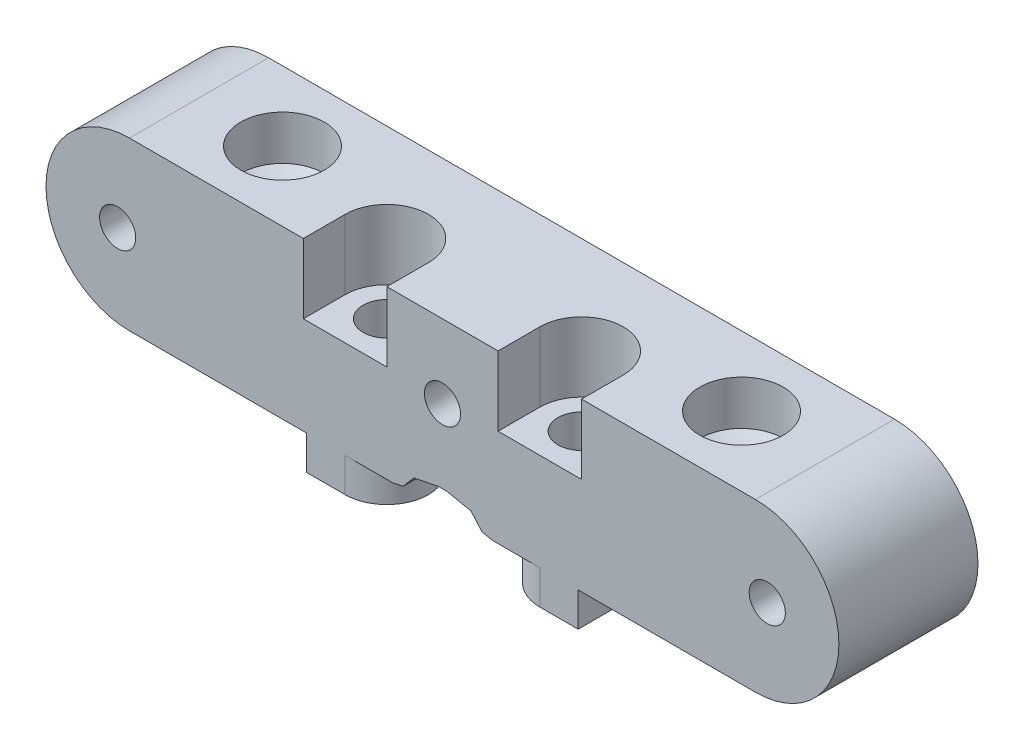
SolidWorks part; units mm, degrees
ref_plane "Płaszczyzna przednia" through (0, 0, 0) normal (0, 0, 1) x (1, 0, 0)
ref_plane "Płaszczyzna górna" through (0, 0, 0) normal (0, 1, 0) x (1, 0, 0)
ref_plane "Płaszczyzna prawa" through (0, 0, 0) normal (1, 0, 0) x (0, 0, -1)
sketch3d "Szkic 3D1"
  line L18 (6.8442, 55.1653, -29.05) -> (6.8442, 55.1653, -10)
  line L19 (6.8442, 55.1653, -10) -> (-3.5, 55.1653, -10)
  line L20 (-3.5, 55.1653, -10) -> (-3.5, 55.1653, 0)
  line L21 (-3.5, 55.1653, 0) -> (8.8442, 55.1653, 0)
  line L22 (8.8442, 55.1653, 0) -> (8.8442, 55.1653, -29.05)
  line L23 (8.8442, 55.1653, -29.05) -> (6.8442, 55.1653, -29.05)
  line L24 (29.1559, 55.1653, -29.05) -> (29.1559, 55.1653, 0)
  line L25 (29.1559, 55.1653, 0) -> (41.5001, 55.1653, 0)
  line L26 (41.5001, 55.1653, 0) -> (41.5001, 55.1653, -10)
  line L27 (41.5001, 55.1653, -10) -> (31.1559, 55.1653, -10)
  line L28 (31.1559, 55.1653, -10) -> (31.1559, 55.1653, -29.05)
  line L29 (31.1559, 55.1653, -29.05) -> (29.1559, 55.1653, -29.05)
  line L30 (29.0359, 79.6512, -6.988) -> (22, 81.5377, -6.988)
  line L31 (22, 81.5377, -6.988) -> (16, 81.5377, -6.988)
  line L32 (16, 81.5377, -6.988) -> (8.9641, 79.6512, -6.988)
  line L33 (8.9641, 71.9242, -6.988) -> (16, 70.0377, -6.988)
  line L34 (16, 70.0377, -6.988) -> (22, 70.0377, -6.988)
  line L35 (22, 70.0377, -6.988) -> (29.0359, 71.9242, -6.988)
  arc A9 (29.0359, 79.6512, -6.988) -> (29.0359, 71.9242, -6.988) centre (28, 75.7877, -6.988) ccw
  arc A10 (8.9641, 71.9242, -6.988) -> (8.9641, 79.6512, -6.988) centre (10, 75.7877, -6.988) ccw
  circle A11 centre (19, 70.4919, 0) radius 1.6
  circle A12 centre (34, 67.4414, 0) radius 2.35
  circle A13 centre (4, 67.4414, 0) radius 2.35
  circle A14 centre (2.5, 55.1653, -5) radius 2.3
  circle A15 centre (35.5001, 55.1653, -5) radius 2.3
  circle A16 centre (10, 75.7877, -6.988) radius 1.6
  circle A17 centre (28, 75.7877, -6.988) radius 1.6
  point P2 (28, 75.7877, -10.988)
  point P4 (10, 75.7877, -10.988)
  point P8 (19, 70.4919, -1.6)
  point P11 (34, 67.4414, -2.35)
  point P16 (4, 67.4414, -2.35)
  point P20 (2.5, 57.4653, -5)
  point P23 (35.5001, 57.4653, -5)
  point P30 (10, 75.7877, -8.588)
  point P36 (28, 75.7877, -8.588)
  dimension "D1" = 4.6
ref_plane "Płaszczyzna1" through (0, 55.1653, 0) normal (0, 1, 0) x (1, 0, 0)
sketch "Szkic2" plane through (0, 55.1653, 0) normal (0, 1, 0) x (1, 0, 0)
  line L1 (-3.5, 0) -> (41.5001, 0)
  line L2 (-3.5, 0) -> (-3.5, 10)
  line L3 (-3.5, 10) -> (41.5001, 10)
  line L4 (41.5001, 0) -> (41.5001, 10)
  circle A0 centre (35.5001, 5) radius 1.7
  circle A1 centre (2.5, 5) radius 1.7
  dimension "D1" = 3.4
extrude "Dodanie-wyciągnięcie1" add sketch "Szkic2" along normal blind 12
sketch "Szkic3" plane through (0, 67.1653, 0) normal (0, 1, 0) x (1, 0, 0)
  line L0 (41.5001, 0) -> (41.5001, 10) construction
  line L1 (-3.5, 0) -> (41.5001, 0)
  line L2 (-3.5, 0) -> (-3.5, 6.5)
  line L3 (-3.5, 6.5) -> (41.5001, 6.5)
  line L4 (41.5001, 0) -> (41.5001, 6.5)
  dimension "D1" = 6.5
extrude "Dodanie-wyciągnięcie2" add sketch "Szkic3" along normal blind 14.5
sketch "Szkic4" plane through (0, 0, -6.5) normal (0, 0, -1) x (-1, 0, 0)
  circle A0 centre (-28, 75.7877) radius 1.7
  circle A1 centre (-10, 75.7877) radius 1.7
  dimension "D1" = 3.4
extrude "Wytnij-wyciągnięcie1" cut sketch "Szkic4" against normal through all
sketch "Szkic5" plane through (0, 67.1653, 0) normal (0, -1, 0) x (1, 0, 0)
  line L1 (34.7001, -6.5) -> (36.3001, -6.5)
  line L2 (34.7001, -6.5) -> (36.3001, -6.5)
  line L3 (1.7, -6.5) -> (3.3, -6.5)
  line L4 (1.7, -6.5) -> (3.3, -6.5)
  arc A1 (36.3001, -6.5) -> (34.7001, -6.5) centre (35.5001, -5) ccw
  arc A2 (36.3001, -6.5) -> (34.7001, -6.5) centre (35.5001, -5) ccw
  arc A3 (3.3, -6.5) -> (1.7, -6.5) centre (2.5, -5) ccw
  arc A4 (3.3, -6.5) -> (1.7, -6.5) centre (2.5, -5) ccw
  dimension "D1" = 0
  dimension "D2" = 0
extrude "Wytnij-wyciągnięcie2" cut sketch "Szkic5" against normal through all
sketch "Szkic7" plane through (0, 0, -10) normal (0, 0, -1) x (-1, 0, 0)
  line L0 (-18.7005, 56.58) -> (-19.2996, 56.58)
  line L1 (-19.2996, 56.58) -> (-21.0498, 56.2301)
  line L2 (-21.0498, 56.2301) -> (-21.8427, 55.3159)
  line L3 (-21.8427, 55.3159) -> (-28.3862, 54.0065)
  line L4 (-28.3862, 54.0065) -> (-29.2559, 52.9456)
  line L5 (-29.2559, 52.9456) -> (-29.2559, 44.935)
  line L6 (-29.2559, 44.935) -> (-28.3862, 43.8741)
  line L7 (-28.3862, 43.8741) -> (-21.8427, 42.5647)
  line L8 (-21.8427, 42.5647) -> (-21.0498, 41.6505)
  line L9 (-21.0498, 41.6505) -> (-19.2996, 41.3006)
  line L10 (-19.2996, 41.3006) -> (-18.7005, 41.3006)
  line L11 (-18.7005, 41.3006) -> (-16.9503, 41.6505)
  line L12 (-16.9503, 41.6505) -> (-16.1574, 42.5647)
  line L13 (-16.1574, 42.5647) -> (-9.6138, 43.8741)
  line L14 (-9.6138, 43.8741) -> (-8.7442, 44.935)
  line L15 (-8.7442, 44.935) -> (-8.7442, 52.9456)
  line L16 (-8.7442, 52.9456) -> (-9.6138, 54.0065)
  line L17 (-9.6138, 54.0065) -> (-16.1574, 55.3159)
  line L18 (-16.1574, 55.3159) -> (-16.9503, 56.2301)
  line L19 (-16.9503, 56.2301) -> (-18.7005, 56.58)
  line L20 (-18.75, 56.08) -> (-19.2501, 56.08)
  line L21 (-19.2501, 56.08) -> (-20.7841, 55.7733)
  line L22 (-20.7841, 55.7733) -> (-21.5769, 54.8591)
  line L23 (-21.5769, 54.8591) -> (-28.1129, 53.5513)
  line L24 (-28.1129, 53.5513) -> (-28.7559, 52.7669)
  line L25 (-28.7559, 52.7669) -> (-28.7559, 45.1137)
  line L26 (-28.7559, 45.1137) -> (-28.1129, 44.3293)
  line L27 (-28.1129, 44.3293) -> (-21.5769, 43.0215)
  line L28 (-21.5769, 43.0215) -> (-20.7841, 42.1073)
  line L29 (-20.7841, 42.1073) -> (-19.2501, 41.8006)
  line L30 (-19.2501, 41.8006) -> (-18.7499, 41.8006)
  line L31 (-18.7499, 41.8006) -> (-17.216, 42.1073)
  line L32 (-17.216, 42.1073) -> (-16.4231, 43.0215)
  line L33 (-16.4231, 43.0215) -> (-9.8872, 44.3293)
  line L34 (-9.8872, 44.3293) -> (-9.2442, 45.1137)
  line L35 (-9.2442, 45.1137) -> (-9.2442, 52.7669)
  line L36 (-9.2442, 52.7669) -> (-9.8872, 53.5513)
  line L37 (-9.8872, 53.5513) -> (-16.4231, 54.8591)
  line L38 (-16.4231, 54.8591) -> (-17.216, 55.7733)
  line L39 (-17.216, 55.7733) -> (-18.75, 56.08)
  line L40 (-18.75, 56.08) -> (-19.2501, 56.08) construction
  line L41 (-19.2501, 56.08) -> (-20.7841, 55.7733) construction
  line L42 (-20.7841, 55.7733) -> (-21.5769, 54.8591) construction
  line L43 (-21.5769, 54.8591) -> (-28.1129, 53.5513) construction
  line L44 (-28.1129, 53.5513) -> (-28.7559, 52.7669) construction
  line L45 (-28.7559, 52.7669) -> (-28.7559, 45.1137) construction
  line L46 (-28.7559, 45.1137) -> (-28.1129, 44.3293) construction
  line L47 (-28.1129, 44.3293) -> (-21.5769, 43.0215) construction
  line L48 (-21.5769, 43.0215) -> (-20.7841, 42.1073) construction
  line L49 (-20.7841, 42.1073) -> (-19.2501, 41.8006) construction
  line L50 (-19.2501, 41.8006) -> (-18.7499, 41.8006) construction
  line L51 (-18.7499, 41.8006) -> (-17.216, 42.1073) construction
  line L52 (-17.216, 42.1073) -> (-16.4231, 43.0215) construction
  line L53 (-16.4231, 43.0215) -> (-9.8872, 44.3293) construction
  line L54 (-9.8872, 44.3293) -> (-9.2442, 45.1137) construction
  line L55 (-9.2442, 45.1137) -> (-9.2442, 52.7669) construction
  line L56 (-9.2442, 52.7669) -> (-9.8872, 53.5513) construction
  line L57 (-9.8872, 53.5513) -> (-16.4231, 54.8591) construction
  line L58 (-16.4231, 54.8591) -> (-17.216, 55.7733) construction
  line L59 (-17.216, 55.7733) -> (-18.75, 56.08) construction
  dimension "D1" = 0
  dimension "D2" = 0.5
extrude "Wytnij-wyciągnięcie3" cut sketch "Szkic7" against normal through all
sketch "Szkic11" plane through (0, 52.7669, 0) normal (0, 1, 0) x (1, 0, 0)
  line L0 (26, 0) -> (28.7559, 0) construction
  line L1 (28.7559, 0) -> (28.7559, 6) construction
  line L2 (28.7559, 6) -> (26, 6) construction
  line L3 (12, 6) -> (9.2442, 6) construction
  line L4 (9.2442, 6) -> (9.2442, 0) construction
  line L5 (9.2442, 0) -> (12, 0) construction
  line L6 (26, 0) -> (28.7559, 0)
  line L7 (28.7559, 0) -> (28.7559, 6)
  line L8 (28.7559, 6) -> (26, 6)
  line L9 (12, 6) -> (9.2442, 6)
  line L10 (9.2442, 6) -> (9.2442, 0)
  line L11 (9.2442, 0) -> (12, 0)
  arc A0 (26, 6) -> (26, 0) centre (26, 3) ccw construction
  arc A1 (12, 0) -> (12, 6) centre (12, 3) ccw construction
  arc A2 (26, 6) -> (26, 0) centre (26, 3) ccw
  arc A3 (12, 0) -> (12, 6) centre (12, 3) ccw
sketch "Szkic13" plane through (0, 55.1653, 0) normal (0, -1, 0) x (1, 0, 0)
  line L0 (28.7559, 0) -> (28.7559, -6) construction
  line L1 (26, 0) -> (28.7559, 0) construction
  line L2 (28.7559, -6) -> (26, -6) construction
  line L3 (12, -6) -> (9.2442, -6) construction
  line L4 (9.2442, 0) -> (12, 0) construction
  line L5 (9.2442, -6) -> (9.2442, 0) construction
  line L6 (28.7559, 0) -> (28.7559, -6)
  line L7 (26, 0) -> (28.7559, 0)
  line L8 (28.7559, -6) -> (26, -6)
  line L9 (12, -6) -> (9.2442, -6)
  line L10 (9.2442, 0) -> (12, 0)
  line L11 (9.2442, -6) -> (9.2442, 0)
  arc A0 (26, 0) -> (26, -6) centre (26, -3) ccw construction
  arc A1 (12, -6) -> (12, 0) centre (12, -3) ccw construction
  arc A2 (26, 0) -> (26, -6) centre (26, -3) ccw
  arc A3 (12, -6) -> (12, 0) centre (12, -3) ccw
extrude "Dodanie-wyciągnięcie4" add sketch "Szkic13" along normal blind 2.45
hole_wizard "Otwór Ø4.6 (4.6)1" positions "Szkic14" profile "Szkic15" hole size "Ø4.6" standard "DIN"
sketch "Szkic14" plane through (0, 0, 0) normal (0, 0, 1) x (1, 0, 0)
  point P0 (28, 75.7877)
  point P3 (10, 75.7877)
sketch "Szkic15" plane through (28, 75.7877, 0) normal (1, 0, 0) x (0, -1, 0)
  line L0 (0, 0) -> (0, 5.5)
  line L1 (0, 5.5) -> (2.3, 4.118)
  line L2 (2.3, 4.118) -> (2.3, 0)
  line L5 (2.3, 0) -> (0, 0)
  line L10 (0, 5.5) -> (-2.3, 4.118) construction
  line L11 (0, -6.35) -> (0, 107.95) construction
  dimension "Średnica otworu" = 4.6
  dimension "Głębokość otworu" = 5.5
  dimension "Kąt wiertła" = 118
sketch "Szkic16" plane through (0, 0, -6.5) normal (0, 0, -1) x (-1, 0, 0)
  line L0 (-16, 81.5377) -> (-8.9641, 79.6512) construction
  line L1 (-29.0359, 79.6512) -> (-22, 81.5377) construction
  line L2 (-16.4759, 81.6653) -> (-8.9641, 79.6512)
  line L3 (-29.0359, 79.6512) -> (-21.5241, 81.6653)
  line L5 (-34.7001, 81.6653) -> (-3.3, 81.6653) construction
  line L6 (-16.4759, 81.6653) -> (3.5, 81.6653)
  line L7 (-32, 75.7877) -> (-32, 67.1653)
  line L8 (-41.5001, 67.1653) -> (3.5, 67.1653) construction
  line L9 (-32, 67.1653) -> (-41.5001, 67.1653)
  line L10 (-41.5001, 67.1653) -> (-41.5001, 81.6653)
  line L11 (-41.5001, 81.6653) -> (-21.5241, 81.6653)
  line L12 (3.5, 81.6653) -> (3.5, 67.1653)
  line L13 (3.5, 67.1653) -> (-6, 67.1653)
  line L14 (-6, 67.1653) -> (-6, 75.7877)
  arc A0 (-8.9641, 71.9242) -> (-8.9641, 79.6512) centre (-10, 75.7877) ccw construction
  arc A1 (-29.0359, 79.6512) -> (-29.0359, 71.9242) centre (-28, 75.7877) ccw construction
  arc A2 (-6, 75.7877) -> (-8.9641, 79.6512) centre (-10, 75.7877) ccw
  arc A3 (-29.0359, 79.6512) -> (-32, 75.7877) centre (-28, 75.7877) ccw
extrude "Wytnij-wyciągnięcie4" cut sketch "Szkic16" against normal through all
sketch "Szkic17" plane through (0, 0, -6.5) normal (0, 0, -1) x (-1, 0, 0)
  line L6 (-8.9641, 79.6512) -> (-16.4759, 81.6653)
  line L7 (-16.4759, 81.6653) -> (-21.5241, 81.6653)
  line L8 (-21.5241, 81.6653) -> (-29.0359, 79.6512)
  line L9 (-32, 75.7877) -> (-32, 67.1653)
  line L10 (-32, 67.1653) -> (-6, 67.1653)
  line L11 (-6, 67.1653) -> (-6, 75.7877)
  line L12 (-8.9641, 79.6512) -> (-16.4759, 81.6653)
  line L13 (-16.4759, 81.6653) -> (-21.5241, 81.6653)
  line L14 (-21.5241, 81.6653) -> (-29.0359, 79.6512)
  line L15 (-32, 75.7877) -> (-32, 67.1653)
  line L16 (-32, 67.1653) -> (-6, 67.1653)
  line L17 (-6, 67.1653) -> (-6, 75.7877)
  arc A2 (-6, 75.7877) -> (-8.9641, 79.6512) centre (-10, 75.7877) ccw
  arc A3 (-29.0359, 79.6512) -> (-32, 75.7877) centre (-28, 75.7877) ccw
  arc A4 (-6, 75.7877) -> (-8.9641, 79.6512) centre (-10, 75.7877) ccw
  arc A5 (-29.0359, 79.6512) -> (-32, 75.7877) centre (-28, 75.7877) ccw
  dimension "D1" = 0
extrude "Wytnij-wyciągnięcie5" cut sketch "Szkic17" against normal through all
sketch "Szkic18" plane through (0, 52.7153, 0) normal (0, -1, 0) x (1, 0, 0)
  circle A0 centre (12, -3) radius 1.7
  circle A1 centre (26, -3) radius 1.7
  dimension "D1" = 3.4
extrude "Wytnij-wyciągnięcie6" cut sketch "Szkic18" against normal through all
hole_wizard "Otwór Ø6.0 (6)2" positions "Szkic21" profile "Szkic22" hole size "Ø6.0" standard "DIN"
sketch "Szkic21" plane through (0, 67.1653, 0) normal (0, 1, 0) x (1, 0, 0)
  point P0 (35.5001, 5)
  point P3 (2.5, 5)
sketch "Szkic22" plane through (35.5001, 67.1653, -5) normal (1, 0, 0) x (0, 0, 1)
  line L0 (0, 0) -> (0, 5)
  line L1 (0, 5) -> (3, 3.1974)
  line L2 (3, 3.1974) -> (3, 0)
  line L5 (3, 0) -> (0, 0)
  line L10 (0, 5) -> (-3, 3.1974) construction
  line L11 (0, -6.35) -> (0, 107.95) construction
  dimension "Średnica otworu" = 6
  dimension "Głębokość otworu" = 5
  dimension "Kąt wiertła" = 118
sketch "Szkic23" plane through (0, 67.1653, 0) normal (0, 1, 0) x (1, 0, 0)
  line L0 (12, 3) -> (12, 0) construction
  line L1 (15, 3) -> (15, 0)
  line L2 (9, 3) -> (9, 0)
  line L3 (26, 3) -> (26, 0) construction
  line L6 (41.5001, 0) -> (-3.5, 0) construction
  line L7 (29, 3) -> (29, 0)
  line L8 (23, 3) -> (23, 0)
  arc A0 (15, 3) -> (9, 3) centre (12, 3) ccw
  arc A1 (9, 0) -> (15, 0) centre (12, 0) ccw
  arc A4 (29, 3) -> (23, 3) centre (26, 3) ccw
  arc A5 (23, 0) -> (29, 0) centre (26, 0) ccw
  point P4 (12, 1.5)
  point P15 (26, 1.5)
  dimension "D1" = 3
  dimension "D2" = 3
extrude "Wytnij-wyciągnięcie7" cut sketch "Szkic23" against normal blind 5
sketch "Szkic27" plane through (0, 0, -10) normal (0, 0, -1) x (-1, 0, 0)
  line L0 (-41.5001, 67.1653) -> (-41.5001, 55.1653) construction
  line L1 (3.5, 67.1653) -> (3.5, 55.1653) construction
  line L2 (-41.5001, 67.1653) -> (-41.5001, 55.1653)
  line L3 (3.5, 67.1653) -> (3.5, 55.1653)
  arc A0 (-41.5001, 67.1653) -> (-41.5001, 55.1653) centre (-41.5001, 61.1653) ccw
  arc A1 (3.5, 67.1653) -> (3.5, 55.1653) centre (3.5, 61.1653) cw
  point P13 (-41.5001, 61.1653)
  point P17 (3.5, 61.1653)
extrude "Dodanie-wyciągnięcie5" add sketch "Szkic27" against normal up to surface (10 mm away)
sketch "Szkic24" plane through (0, 0, -10) normal (0, 0, -1) x (-1, 0, 0)
  line L0 (-41.5001, 67.1653) -> (3.5, 67.1653) construction
  line L1 (-19, 67.1653) -> (-19, 56.58) construction
  line L2 (-18.7005, 56.58) -> (-19.2996, 56.58) construction
  line L3 (-42.3501, 61.1653) -> (4.35, 61.1653) construction
  circle A0 centre (-19, 61.8726) radius 1.3
  circle A1 centre (-42.3501, 61.1653) radius 2.35 construction
  arc A2 (-41.5001, 67.1653) -> (-41.5001, 55.1653) centre (-41.5001, 61.1653) ccw construction
  circle A3 centre (-42.3501, 61.1653) radius 1.3
  circle A4 centre (4.35, 61.1653) radius 1.3
  point P4 (-19, 67.1653)
  point P10 (-19, 61.8726)
  point P14 (-19, 61.1653)
  dimension "D1" = 2.6
  dimension "D2" = 4.7
  dimension "D3" = 2.8
extrude "Wytnij-wyciągnięcie8" cut sketch "Szkic24" against normal through all
hole_wizard "Otwór Ø4.6 (4.6)2" positions "Szkic25" profile "Szkic26" hole size "Ø4.6" standard "DIN"
sketch "Szkic25" plane through (0, 0, -10) normal (0, 0, -1) x (-1, 0, 0)
  point P0 (-19, 61.8726)
  point P4 (-42.3501, 61.1653)
  point P7 (4.35, 61.1653)
sketch "Szkic26" plane through (19, 61.8726, -10) normal (1, 0, 0) x (0, 1, 0)
  line L0 (0, 0) -> (0, 6)
  line L1 (0, 6) -> (2.3, 4.618)
  line L2 (2.3, 4.618) -> (2.3, 0)
  line L5 (2.3, 0) -> (0, 0)
  line L10 (0, 6) -> (-2.3, 4.618) construction
  line L11 (0, -6.35) -> (0, 107.95) construction
  dimension "Średnica otworu" = 4.6
  dimension "Głębokość otworu" = 6
  dimension "Kąt wiertła" = 118
